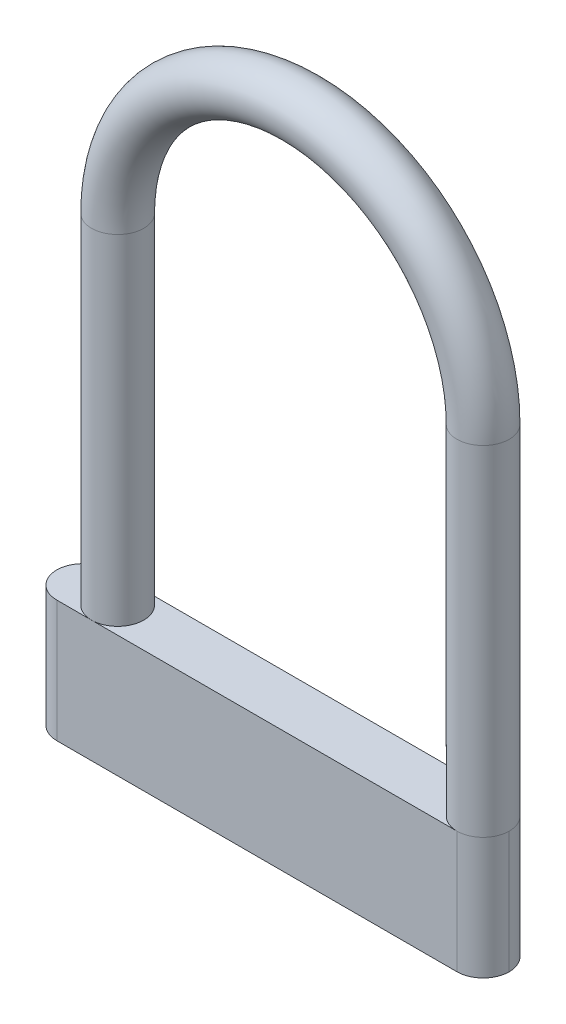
SolidWorks part; units mm, degrees
ref_plane "Plan de face" through (0, 0, 0) normal (0, 0, 1) x (1, 0, 0)
ref_plane "Plan de dessus" through (0, 0, 0) normal (0, 1, 0) x (1, 0, 0)
ref_plane "Plan de droite" through (0, 0, 0) normal (1, 0, 0) x (0, 0, -1)
sketch "Esquisse1" plane through (0, 0, 0) normal (0, 0, 1) x (1, 0, 0)
  line L0 (0, 0) -> (0, 19.5)
  line L1 (21, 0) -> (21, 19.5)
  arc A0 (0, 19.5) -> (21, 19.5) centre (10.5, 19.5) cw
  dimension "D1" = 10.5
  dimension "D2" = 19.5
  dimension "D3" = 19.5
sketch "Esquisse2" plane through (0, 0, 0) normal (0, 1, 0) x (1, 0, 0)
  circle A0 centre (0, 0) radius 1.5
  dimension "D1" = 3
sweep "Balayage1" add profiles "Esquisse2" path "Esquisse1"
sketch "Esquisse3" plane through (0, 0, 0) normal (0, 1, 0) x (1, 0, 0)
  line L1 (-3.5, -1.5) -> (22.5, -1.5)
  line L2 (-3.5, -1.5) -> (-3.5, 1.5)
  line L3 (-3.5, 1.5) -> (22.5, 1.5)
  line L4 (22.5, -1.5) -> (22.5, 1.5)
  circle A0 centre (21, 0) radius 1.5 construction
  dimension "D1" = 26
  dimension "D2" = 3
  dimension "D3" = 1.5
extrude "Extrusion1" add sketch "Esquisse3" against normal blind 7
fillet "Congé1" radius 1.5 4 edges at (22.5, -3.5, -1.5) (22.5, -3.5, 1.5) (-3.5, -3.5, -1.5) (-3.5, -3.5, 1.5)
